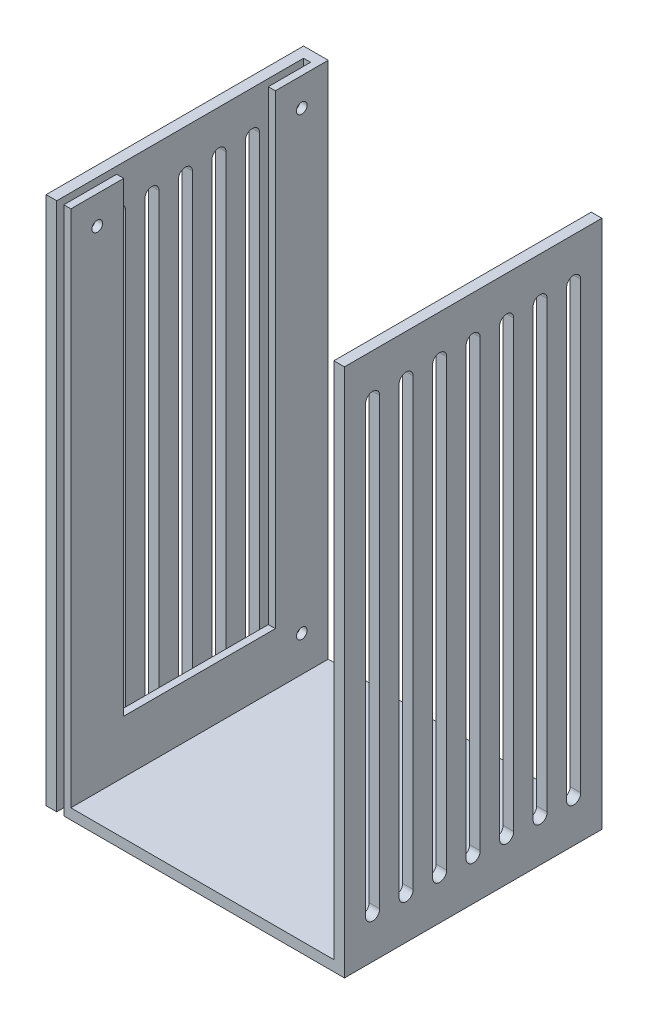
SolidWorks part; units mm, degrees
ref_plane "Front Plane" through (0, 0, 0) normal (0, 0, 1) x (1, 0, 0)
ref_plane "Top Plane" through (0, 0, 0) normal (0, 1, 0) x (1, 0, 0)
ref_plane "Right Plane" through (0, 0, 0) normal (1, 0, 0) x (0, 0, -1)
sketch "Croquis4" plane through (0, 0, 0) normal (0, 1, 0) x (1, 0, 0)
  line L0 (-528.3621, 42.3071) -> (-535.3621, 42.3071)
  line L10 (-532.3621, -30.6929) -> (-532.3621, 39.3071)
  line L12 (-535.3621, 42.3071) -> (-535.3621, -30.6929)
  line L13 (-535.3621, -30.6929) -> (-532.3621, -30.6929)
  line L15 (-532.3621, 39.3071) -> (-530.3621, 39.3071)
  line L16 (-453.7621, 42.3071) -> (-450.7621, 42.3071)
  line L17 (-453.7621, 42.3071) -> (-453.7621, -30.6929)
  line L18 (-453.7621, -30.6929) -> (-450.7621, -30.6929)
  line L19 (-450.7621, 42.3071) -> (-450.7621, -30.6929)
  line L22 (-530.3621, 39.3071) -> (-530.3621, -30.6929)
  line L23 (-530.3621, -30.6929) -> (-528.3621, -30.6929)
  line L24 (-528.3621, 42.3071) -> (-528.3621, -30.6929)
  dimension "D1" = 73
  dimension "D2" = 84.6
  dimension "D3" = 7
  dimension "D4" = 3
  dimension "D5" = 2
  dimension "D6" = 73
  dimension "D7" = 73
  dimension "D8" = 2
  dimension "D9" = 73
  dimension "D10" = 2
extrude "Saliente-Extruir2" add sketch "Croquis4" along normal blind 150.1
sketch "Croquis6" plane through (-535.3621, 0, 0) normal (-1, 0, 0) x (0, 0, 1)
  line L0 (-42.3071, 0) -> (30.6929, 0) construction
  line L2 (-36.3071, 138.1) -> (-36.3071, 12)
  line L4 (-32.3071, 138.1) -> (-32.3071, 12)
  line L6 (-42.3071, 150.1) -> (30.6929, 150.1) construction
  line L10 (-42.3071, 150.1) -> (-42.3071, 0) construction
  line L11 (-26.8071, 138.1) -> (-26.8071, 12)
  line L12 (-22.8071, 138.1) -> (-22.8071, 12)
  line L13 (-7.8071, 138.1) -> (-7.8071, 12)
  line L14 (-3.8071, 138.1) -> (-3.8071, 12)
  line L15 (-17.3071, 138.1) -> (-17.3071, 12)
  line L16 (-13.3071, 138.1) -> (-13.3071, 12)
  line L17 (20.6929, 138.1) -> (20.6929, 12)
  line L18 (15.1929, 138.1) -> (15.1929, 12)
  line L19 (1.6929, 138.1) -> (1.6929, 12)
  line L20 (11.1929, 138.1) -> (11.1929, 12)
  line L21 (24.6929, 138.1) -> (24.6929, 12)
  line L22 (5.6929, 138.1) -> (5.6929, 12)
  line L23 (30.6929, 150.1) -> (30.6929, 0) construction
  arc A0 (-36.3071, 12) -> (-32.3071, 12) centre (-34.3071, 12) ccw
  arc A1 (-36.3071, 138.1) -> (-32.3071, 138.1) centre (-34.3071, 138.1) cw
  arc A2 (-26.8071, 12) -> (-22.8071, 12) centre (-24.8071, 12) ccw
  arc A3 (-26.8071, 138.1) -> (-22.8071, 138.1) centre (-24.8071, 138.1) cw
  arc A4 (-7.8071, 12) -> (-3.8071, 12) centre (-5.8071, 12) ccw
  arc A5 (-17.3071, 12) -> (-13.3071, 12) centre (-15.3071, 12) ccw
  arc A6 (-7.8071, 138.1) -> (-3.8071, 138.1) centre (-5.8071, 138.1) cw
  arc A7 (-17.3071, 138.1) -> (-13.3071, 138.1) centre (-15.3071, 138.1) cw
  arc A8 (1.6929, 138.1) -> (5.6929, 138.1) centre (3.6929, 138.1) cw
  arc A9 (20.6929, 138.1) -> (24.6929, 138.1) centre (22.6929, 138.1) cw
  arc A10 (11.1929, 138.1) -> (15.1929, 138.1) centre (13.1929, 138.1) cw
  arc A11 (1.6929, 12) -> (5.6929, 12) centre (3.6929, 12) ccw
  arc A12 (11.1929, 12) -> (15.1929, 12) centre (13.1929, 12) ccw
  arc A13 (20.6929, 12) -> (24.6929, 12) centre (22.6929, 12) ccw
  dimension "D4" = 12
  dimension "D5" = 6
  dimension "D2" = 12
  dimension "D1" = 2
  dimension "D7" = 2
  dimension "D10" = 2
  dimension "D12" = 2
  dimension "D16" = 2
  dimension "D18" = 2
  dimension "D20" = 2
  dimension "D3" = 4
  dimension "D6" = 4
  dimension "D8" = 5.5
  dimension "D9" = 4
  dimension "D11" = 4
  dimension "D13" = 5.5
  dimension "D14" = 5.5
  dimension "D15" = 4
  dimension "D17" = 4
  dimension "D19" = 4
  dimension "D21" = 5.5
  dimension "D22" = 5.5
  dimension "D23" = 5.5
  dimension "D24" = 6
extrude "Cortar-Extruir1" cut sketch "Croquis6" along direction (1, 0, 0) on the side against the normal up to surface (3 mm away)
sketch "Croquis9" plane through (-450.7621, 0, 0) normal (1, 0, 0) x (0, 0, -1)
  line L0 (-24.6929, 138.1) -> (-24.6929, 12)
  line L1 (-20.6929, 138.1) -> (-20.6929, 12)
  line L2 (-15.1929, 138.1) -> (-15.1929, 12)
  line L3 (-11.1929, 138.1) -> (-11.1929, 12)
  line L4 (3.8071, 138.1) -> (3.8071, 12)
  line L5 (7.8071, 138.1) -> (7.8071, 12)
  line L6 (-5.6929, 138.1) -> (-5.6929, 12)
  line L7 (-1.6929, 138.1) -> (-1.6929, 12)
  line L8 (32.3071, 138.1) -> (32.3071, 12)
  line L9 (26.8071, 138.1) -> (26.8071, 12)
  line L10 (13.3071, 138.1) -> (13.3071, 12)
  line L11 (22.8071, 138.1) -> (22.8071, 12)
  line L12 (36.3071, 138.1) -> (36.3071, 12)
  line L13 (17.3071, 138.1) -> (17.3071, 12)
  line L14 (-30.6929, 150.1) -> (-30.6929, 0) construction
  line L16 (-30.6929, 150.1) -> (42.3071, 150.1) construction
  line L18 (42.3071, 150.1) -> (42.3071, 0) construction
  arc A0 (-24.6929, 12) -> (-20.6929, 12) centre (-22.6929, 12) ccw
  arc A1 (-24.6929, 138.1) -> (-20.6929, 138.1) centre (-22.6929, 138.1) cw
  arc A2 (-15.1929, 12) -> (-11.1929, 12) centre (-13.1929, 12) ccw
  arc A3 (-15.1929, 138.1) -> (-11.1929, 138.1) centre (-13.1929, 138.1) cw
  arc A4 (3.8071, 12) -> (7.8071, 12) centre (5.8071, 12) ccw
  arc A5 (-5.6929, 12) -> (-1.6929, 12) centre (-3.6929, 12) ccw
  arc A6 (3.8071, 138.1) -> (7.8071, 138.1) centre (5.8071, 138.1) cw
  arc A7 (-5.6929, 138.1) -> (-1.6929, 138.1) centre (-3.6929, 138.1) cw
  arc A8 (13.3071, 138.1) -> (17.3071, 138.1) centre (15.3071, 138.1) cw
  arc A9 (32.3071, 138.1) -> (36.3071, 138.1) centre (34.3071, 138.1) cw
  arc A10 (22.8071, 138.1) -> (26.8071, 138.1) centre (24.8071, 138.1) cw
  arc A11 (13.3071, 12) -> (17.3071, 12) centre (15.3071, 12) ccw
  arc A12 (22.8071, 12) -> (26.8071, 12) centre (24.8071, 12) ccw
  arc A13 (32.3071, 12) -> (36.3071, 12) centre (34.3071, 12) ccw
  dimension "D2" = 2
  dimension "D4" = 2
  dimension "D7" = 2
  dimension "D9" = 2
  dimension "D13" = 2
  dimension "D15" = 2
  dimension "D21" = 12
  dimension "D23" = 2
  dimension "D1" = 4
  dimension "D3" = 4
  dimension "D5" = 5.5
  dimension "D6" = 4
  dimension "D8" = 4
  dimension "D10" = 5.5
  dimension "D11" = 5.5
  dimension "D12" = 4
  dimension "D14" = 4
  dimension "D16" = 4
  dimension "D17" = 5.5
  dimension "D18" = 5.5
  dimension "D19" = 5.5
  dimension "D20" = 6
  dimension "D22" = 6
extrude "Cortar-Extruir2" cut sketch "Croquis9" along direction (-1, 0, 0) on the side against the normal up to surface (3 mm away)
hole_wizard "Ø3.0mm Dowel Hole1" positions "Croquis3D1" profile "Croquis18" hole size "Ø3.0" standard "ISO"
sketch3d "Croquis3D1"
  line L3 (-528.3621, 150.1, -42.3071) -> (-528.3621, 0, -42.3071) construction
  line L5 (-528.3621, 150.1, 30.6929) -> (-528.3621, 150.1, -42.3071) construction
  line L6 (-528.3621, 150.1, 30.6929) -> (-528.3621, 0, 30.6929) construction
  point P0 (-528.3621, 142.1, 23.1929)
  point P2 (-528.3621, 142.1, -34.8071)
  point P4 (-528.3621, 13.1, -34.8071)
  dimension "D1" = 129
  dimension "D2" = 58
  dimension "D3" = 8
  dimension "D4" = 7.5
  dimension "D5" = 7.5
  dimension "D6" = 8
sketch "Croquis18" plane through (-528.3621, 142.1, 23.1929) normal (0, 1, 0) x (0, 0, -1)
  line L0 (0, 0) -> (0, 5)
  line L1 (0, 5) -> (1.5, 5)
  line L2 (1.5, 5) -> (1.5, 0)
  line L5 (1.5, 0) -> (0, 0)
  line L10 (0, 5) -> (-1.5, 5) construction
  line L11 (0, -6.35) -> (0, 107.95) construction
  dimension "Hole Dia." = 3
  dimension "Hole Depth" = 5
  dimension "Drill Angle" = 180
sketch "Croquis19" plane through (0, 0, 0) normal (0, -1, 0) x (1, 0, 0)
  line L1 (-528.3621, 30.6929) -> (-453.7621, 30.6929)
  line L2 (-528.3621, 30.6929) -> (-528.3621, -42.3071)
  line L3 (-528.3621, -42.3071) -> (-453.7621, -42.3071)
  line L4 (-453.7621, 30.6929) -> (-453.7621, -42.3071)
extrude "Saliente-Extruir3" add sketch "Croquis19" against normal blind 3
sketch "Croquis20" plane through (-528.3621, 0, 0) normal (1, 0, 0) x (0, 0, -1)
  line L0 (-30.6929, 150.1) -> (42.3071, 150.1) construction
  line L1 (27.3071, 150.1) -> (-15.6929, 150.1)
  line L2 (27.3071, 150.1) -> (27.3071, 18)
  line L3 (27.3071, 18) -> (-15.6929, 18)
  line L4 (-15.6929, 150.1) -> (-15.6929, 18)
  line L5 (42.3071, 150.1) -> (42.3071, 3) construction
  line L6 (-30.6929, 150.1) -> (-30.6929, 3) construction
  line L7 (-30.6929, 3) -> (42.3071, 3) construction
  dimension "D1" = 15
  dimension "D2" = 15
  dimension "D3" = 15
extrude "Cortar-Extruir3" cut sketch "Croquis20" against normal up to surface (2 mm away)
